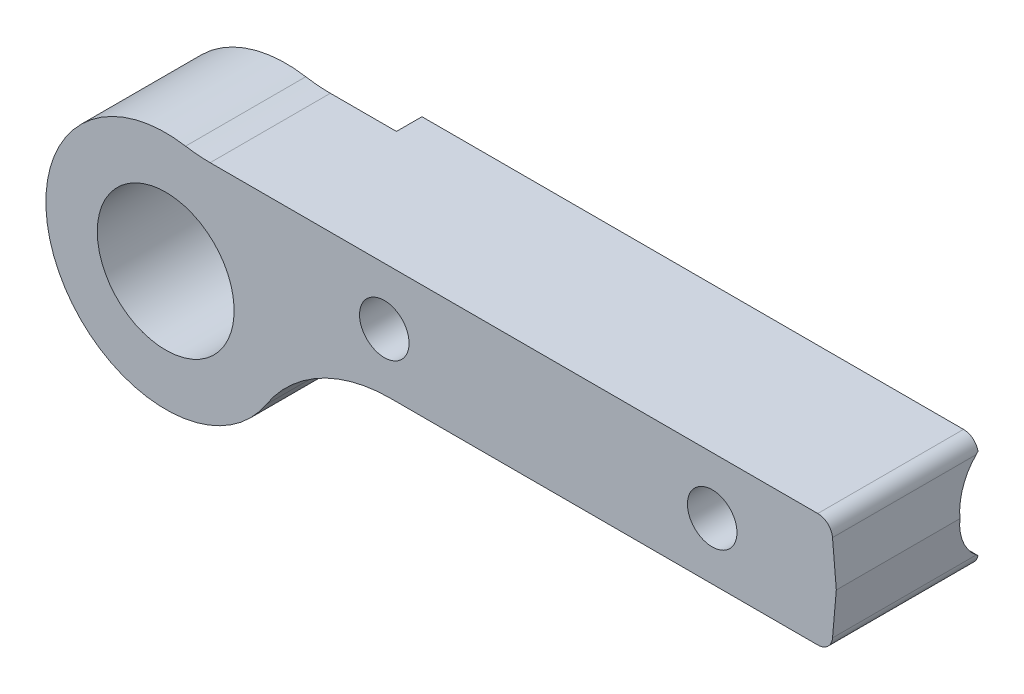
SolidWorks part; units mm, degrees
ref_plane "Plan1" through (0, 0, 0) normal (0, 0, 1) x (1, 0, 0)
ref_plane "Plan2" through (0, 0, 0) normal (0, 1, 0) x (1, 0, 0)
ref_plane "Plan3" through (0, 0, 0) normal (1, 0, 0) x (0, 0, -1)
sketch "Esquisse1" plane through (0, 0, 0) normal (0, 0, 1) x (1, 0, 0)
  line L0 (-20, 0) -> (30, 0) construction
  line L1 (-20, 8.12) -> (103.692, 8.12) construction
  line L2 (6.1008, 15.935) -> (89.4898, 15.935)
  line L3 (91.5121, 14.0819) -> (92.0337, 8.12)
  line L4 (91.5121, 2.1581) -> (92.0337, 8.12)
  line L5 (30.8285, 0.305) -> (89.4898, 0.305)
  arc A0 (2.7304, 16.2168) -> (13.7971, -8.9486) centre (0, 0) ccw
  arc A1 (89.4898, 15.935) -> (91.5121, 14.0819) centre (89.4898, 13.905) cw
  arc A2 (89.4898, 0.305) -> (91.5121, 2.1581) centre (89.4898, 2.335) ccw
  arc A3 (30.8285, 0.305) -> (13.7971, -8.9486) centre (30.8285, -19.995) ccw
  arc A4 (2.7304, 16.2168) -> (6.1008, 15.935) centre (6.1008, 36.235) ccw
  point P4 (0, 0)
  point P12 (91.35, 15.935)
  dimension "D1" = 32.89
  dimension "D6" = 2.03
  dimension "D7" = 20.3
  dimension "D8" = 20.3
  dimension "D2" = 8.12
  dimension "D3" = 7.815
  dimension "D4" = 85
  dimension "D5" = 91.35
extrude "Base-Extrusion" add sketch "Esquisse1" along normal blind 20
sketch "Esquisse3" plane through (0, 0, 0) normal (0, 0, -1) x (-1, 0, 0)
  circle A0 centre (0, 0) radius 22
  dimension "D1" = 44
extrude "Enlèv. mat.-Extru.1" cut sketch "Esquisse3" against normal blind 3.5
ref_plane "Plan4" through (95, 0, 0) normal (1, 0, 0) x (0, 0, -1)
sketch "Esquisse4" plane through (95, 0, 0) normal (1, 0, 0) x (0, 0, -1)
  line L0 (-29.432, 8.12) -> (41.2048, 8.12) construction
  line L1 (4.77, 36.235) -> (4.77, -26.2926) construction
  line L2 (-20, 36.235) -> (-3.5, 36.235) construction
  line L3 (-3.5, -16.445) -> (-3.5, 16.445) construction
  circle A0 centre (4.77, 8.12) radius 7.815
  dimension "D1" = 15.63
  dimension "D2" = 8.27
extrude "Enlèv. mat.-Extru.2" cut sketch "Esquisse4" against normal through all
sketch "Esquisse5" plane through (0, 0, 3.5) normal (0, 0, -1) x (-1, 0, 0)
  circle A0 centre (0, 0) radius 9.39
  dimension "D1" = 18.78
extrude "Enlèv. mat.-Extru.3" cut sketch "Esquisse5" against normal through all
hole_wizard "Trou taraudé M8x1.252" positions "Esquisse10" profile "Esquisse9" tap size "M8x1.25" standard "ISO"
sketch "Esquisse10" plane through (0, 0, 20) normal (0, 0, 1) x (1, 0, 0)
  line L0 (-31.9081, 8.12) -> (14.4812, 8.12) construction
  point P0 (30, 8.12)
  point P1 (75, 8.12)
  dimension "D1" = 45
  dimension "D2" = 30
sketch "Esquisse9" plane through (30, 8.12, 20) normal (1, 0, 0) x (0, -1, 0)
  line L0 (0, 0) -> (0, 20.6724)
  line L1 (0, 20.6724) -> (3.4, 20.6724)
  line L2 (3.4, 20.6724) -> (3.4, 0)
  line L5 (3.4, 0) -> (0, 0)
  line L11 (0, -6.35) -> (0, 107.95) construction
  dimension "Diamètre du perçage jusqu'au prochain" = 6.8
  dimension "Profondeur du perçage jusqu'au prochain" = 20.6724
